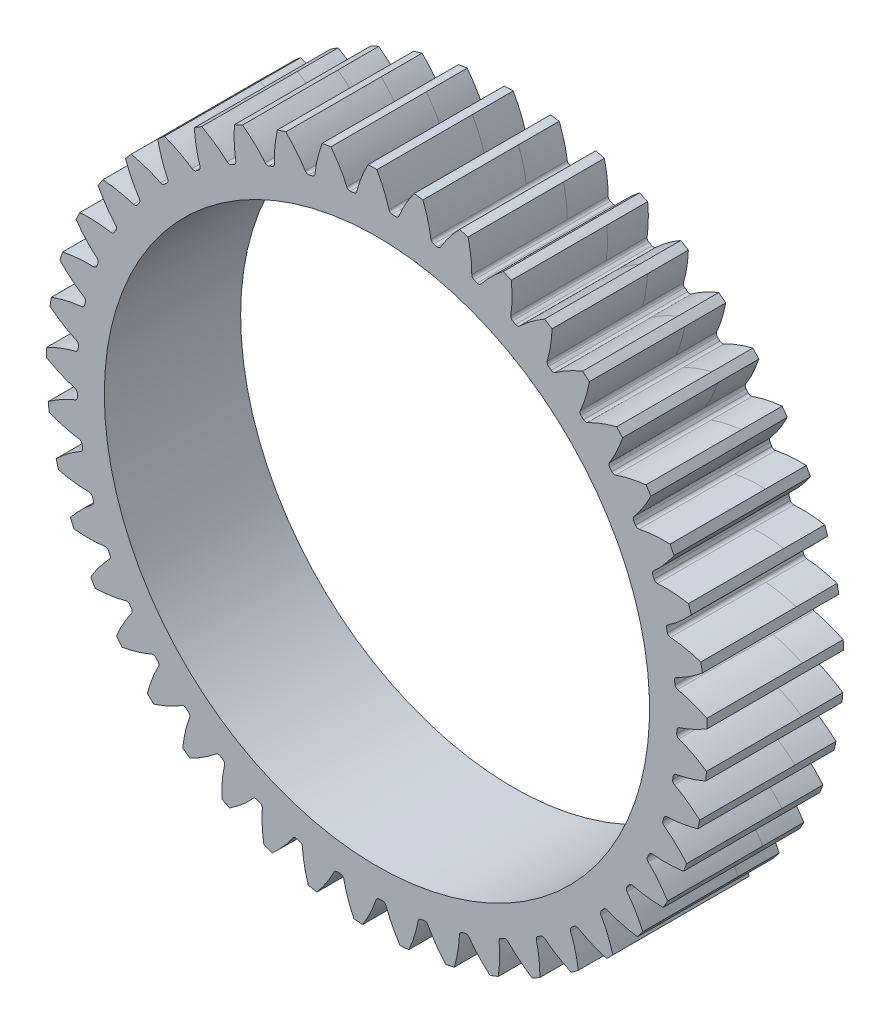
SolidWorks part; units mm, degrees
ref_plane "Face" through (0, 0, 0) normal (0, 0, 1) x (1, 0, 0)
ref_plane "Dessus" through (0, 0, 0) normal (0, 1, 0) x (1, 0, 0)
ref_plane "Droite" through (0, 0, 0) normal (1, 0, 0) x (0, 0, -1)
imported_body "Importée1"
sketch "Esquisse1" plane through (0, 0, 2.8) normal (0, 0, 1) x (1, 0, 0)
  circle A0 centre (0, 0) radius 9.375
  dimension "D1" = 18.75
surface "Surface-primitive" sketch "Esquisse1"
